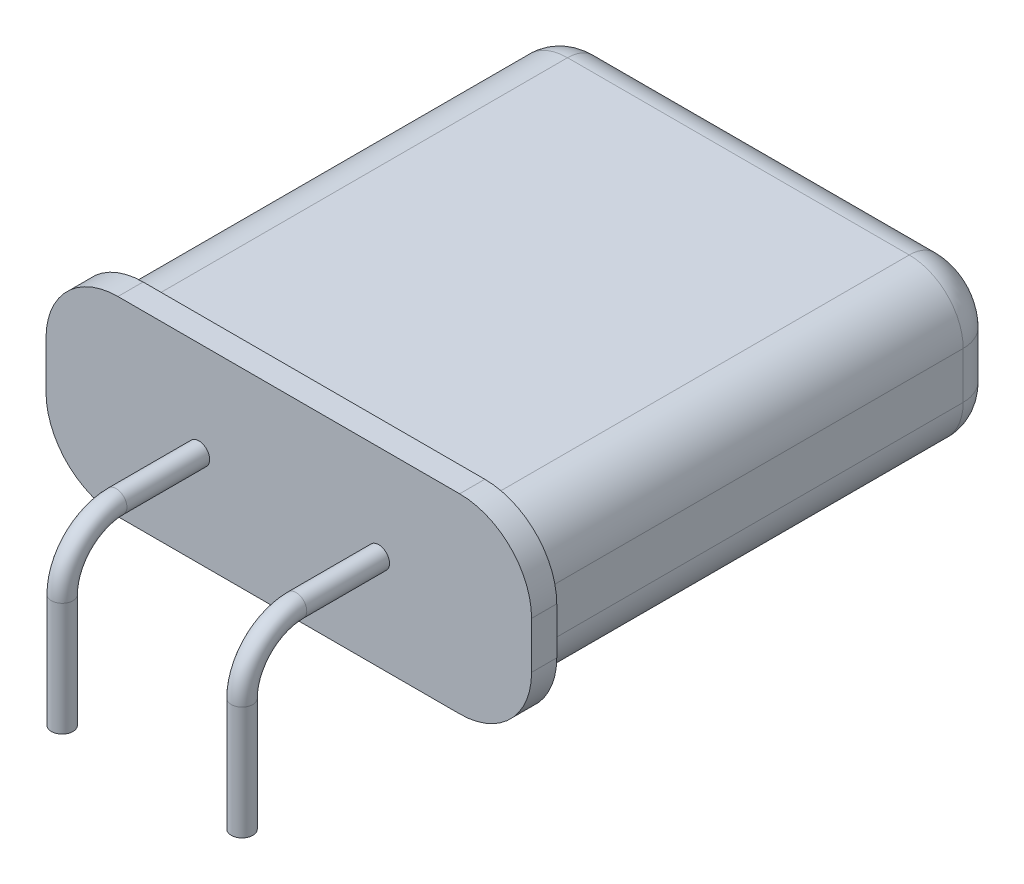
SolidWorks part; units mm, degrees
ref_plane "Front" through (0, 0, 0) normal (0, 0, 1) x (1, 0, 0)
ref_plane "Top" through (0, 0, 0) normal (0, 1, 0) x (1, 0, 0)
ref_plane "Right" through (0, 0, 0) normal (1, 0, 0) x (0, 0, -1)
sketch "Эскиз1" plane through (0, 0, 0) normal (0, 0, 1) x (1, 0, 0)
  line L1 (2, 0) -> (11.5, 0)
  line L2 (0, 2) -> (0, 3.3)
  line L3 (2, 5.3) -> (11.5, 5.3)
  line L4 (13.5, 2) -> (13.5, 3.3)
  arc A0 (0, 3.3) -> (2, 5.3) centre (2, 3.3) cw
  arc A1 (11.5, 5.3) -> (13.5, 3.3) centre (11.5, 3.3) cw
  arc A2 (2, 0) -> (0, 2) centre (2, 2) cw
  arc A3 (11.5, 0) -> (13.5, 2) centre (11.5, 2) ccw
  point P6 (0, 5.3)
  point P11 (0, 0)
  point P14 (13.5, 0)
  dimension "D3" = 2
  dimension "D1" = 5.3
  dimension "D2" = 13.5
extrude "Вытянуть1" add sketch "Эскиз1" against normal blind 0.7
sketch "Эскиз2" plane through (0, 0, -0.7) normal (0, 0, -1) x (-1, 0, 0)
  line L8 (-2, 4.8) -> (-11.5, 4.8)
  line L9 (-13, 3.3) -> (-13, 2)
  line L10 (-11.5, 0.5) -> (-2, 0.5)
  line L11 (-0.5, 2) -> (-0.5, 3.3)
  line L12 (-2, 4.8) -> (-11.5, 4.8)
  line L13 (-13, 3.3) -> (-13, 2)
  line L14 (-11.5, 0.5) -> (-2, 0.5)
  line L15 (-0.5, 2) -> (-0.5, 3.3)
  arc A8 (-11.5, 4.8) -> (-13, 3.3) centre (-11.5, 3.3) ccw
  arc A9 (-13, 2) -> (-11.5, 0.5) centre (-11.5, 2) ccw
  arc A10 (-2, 0.5) -> (-0.5, 2) centre (-2, 2) ccw
  arc A11 (-0.5, 3.3) -> (-2, 4.8) centre (-2, 3.3) ccw
  arc A12 (-11.5, 4.8) -> (-13, 3.3) centre (-11.5, 3.3) ccw
  arc A13 (-13, 2) -> (-11.5, 0.5) centre (-11.5, 2) ccw
  arc A14 (-2, 0.5) -> (-0.5, 2) centre (-2, 2) ccw
  arc A15 (-0.5, 3.3) -> (-2, 4.8) centre (-2, 3.3) ccw
  dimension "D1" = 0.5
extrude "Вытянуть2" add sketch "Эскиз2" along normal blind 12.8
fillet "Скругление1" radius 1 8 edges at (0.9393, 4.3607, -13.5) (0.5, 2.65, -13.5) (0.9393, 0.9393, -13.5) (6.75, 0.5, -13.5) (12.5607, 0.9393, -13.5) (13, 2.65, -13.5) (12.5607, 4.3607, -13.5) (6.75, 4.8, -13.5)
sketch "Эскиз4" plane through (0, 0, 0) normal (1, 0, 0) x (0, 0, -1)
  line L0 (0, 2.65) -> (-2.3, 2.65)
  line L1 (0, 2) -> (0, 3.3) construction
  line L2 (-3.8, 1.15) -> (-3.8, -2)
  arc A0 (-2.3, 2.65) -> (-3.8, 1.15) centre (-2.3, 1.15) ccw
  point P8 (-3.8, 2.65)
  dimension "D2" = 1.5
  dimension "D1" = 3.8
  dimension "D3" = 2
sketch "Эскиз5" plane through (0, 0, 0) normal (0, 0, 1) x (1, 0, 0)
  line L0 (6.75, 5.3) -> (6.75, 0) construction
  line L1 (11.5, 5.3) -> (2, 5.3) construction
  line L2 (2, 0) -> (11.5, 0) construction
  line L3 (13.5, 2.65) -> (0, 2.65) construction
  line L4 (13.5, 2) -> (13.5, 3.3) construction
  circle A0 centre (9.25, 2.65) radius 0.3
  circle A1 centre (4.25, 2.65) radius 0.3
  dimension "D1" = 0.6
  dimension "D2" = 5
sweep "По траектории1" add profiles "Эскиз5" path "Эскиз4"
